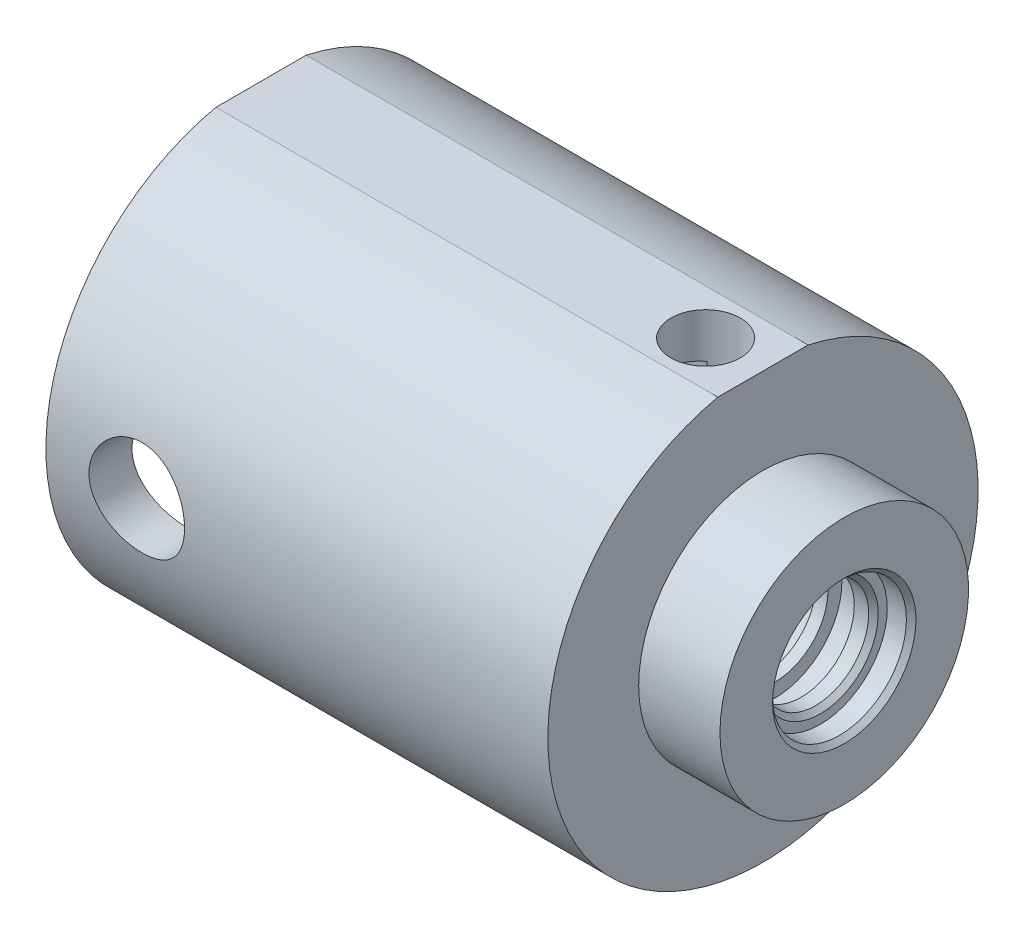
SolidWorks part; units mm, degrees
ref_plane "Face" through (0, 0, 0) normal (0, 0, 1) x (1, 0, 0)
ref_plane "Dessus" through (0, 0, 0) normal (0, 1, 0) x (1, 0, 0)
ref_plane "Droite" through (0, 0, 0) normal (1, 0, 0) x (0, 0, -1)
sketch "Esquisse1" plane through (0, 0, 0) normal (0, 0, 1) x (1, 0, 0)
  line L0 (0, 0) -> (148.1373, 0) construction
  line L1 (0, 0) -> (0, 45)
  line L2 (0, 45) -> (105, 45)
  line L5 (105, 45) -> (105, 26)
  line L6 (105, 26) -> (122, 26)
  line L7 (122, 26) -> (122, 0)
  line L8 (122, 0) -> (0, 0)
  dimension "D2" = 26
  dimension "D3" = 45
  dimension "D5" = 122
  dimension "D6" = 17
revolve "Révolution1" add sketch "Esquisse1" angle 360 about L0
sketch "Esquisse2" plane through (0, 0, 0) normal (0, 0, 1) x (1, 0, 0)
  line L0 (0, 0) -> (0, 36)
  line L1 (0, 45) -> (0, -45) construction
  line L2 (0, 36) -> (3, 36)
  line L3 (3, 36) -> (3, 37.5)
  line L4 (3, 37.5) -> (7, 37.5)
  line L5 (7, 37.5) -> (7, 36)
  line L6 (7, 36) -> (32, 36)
  line L7 (32, 36) -> (34.7475, 35)
  line L8 (34.7475, 35) -> (88, 35)
  line L9 (88, 35) -> (88, 11.1)
  line L10 (88, 11.1) -> (89.8, 11.1)
  line L11 (89.8, 11.1) -> (89.8, 13)
  line L12 (89.8, 13) -> (105, 13)
  line L13 (105, 13) -> (105, 11.1)
  line L14 (105, 11.1) -> (107.5, 11.1)
  line L15 (107.5, 11.1) -> (107.5, 14)
  line L16 (107.5, 14) -> (113, 14)
  line L17 (113, 14) -> (113, 11.1)
  line L18 (113, 11.1) -> (117, 11.1)
  line L19 (117, 11.1) -> (117, 14)
  line L20 (117, 14) -> (122, 14)
  line L21 (122, -26) -> (122, 26) construction
  line L22 (122, 14) -> (122, 0)
  line L23 (122, 0) -> (0, 0)
  dimension "D1" = 11.1
  dimension "D2" = 13
  dimension "D3" = 5
  dimension "D4" = 9
  dimension "D5" = 5.5
  dimension "D6" = 17
  dimension "D7" = 15.2
  dimension "D8" = 88
  dimension "D9" = 3
  dimension "D10" = 4
  dimension "D11" = 32
  dimension "D12" = 160
  dimension "D13" = 35
  dimension "D14" = 36
  dimension "D15" = 37.5
  dimension "D16" = 36
  dimension "D17" = 14
revolve "Enlèvement de matière-Révolution1" cut sketch "Esquisse2" angle 360 about L23
chamfer "Chanfrein1" distance 1 angle 45 2 edges at (117, 0, -11.1) (122, 0, -14)
sketch "Esquisse4" plane through (105, 0, 0) normal (1, 0, 0) x (0, 0, -1)
  line L1 (72.23, 44) -> (-59.9876, 44)
  line L2 (72.23, 44) -> (72.23, 74.7808)
  line L3 (72.23, 74.7808) -> (-59.9876, 74.7808)
  line L4 (-59.9876, 44) -> (-59.9876, 74.7808)
  dimension "D1" = 44
extrude "Enlèv. mat.-Extru.1" cut sketch "Esquisse4" against normal through all
hole_wizard "Trou taraudé G3/8" positions "Esquisse6" profile "Esquisse5" tap size "M16x1.5" standard "Ansi Métrique"
sketch "Esquisse6" plane through (0, 44, 0) normal (0, 1, 0) x (-1, 0, 0)
  line L0 (-105, -9.434) -> (-105, 9.434) construction
  line L1 (0, 0) -> (-148.1373, 0) construction
  point P0 (-93, 0)
  dimension "D1" = 12
sketch "Esquisse5" plane through (93, 44, 0) normal (1, 0, 0) x (0, 0, 1)
  line L0 (0, 0) -> (0, 26.8562)
  line L1 (0, 26.8562) -> (7.25, 22.5)
  line L2 (7.25, 22.5) -> (7.25, 0)
  line L5 (7.25, 0) -> (0, 0)
  line L10 (0, 26.8562) -> (-7.25, 22.5) construction
  line L11 (0, -6.35) -> (0, 107.95) construction
  dimension "Diamètre du trou pour taraudage" = 14.5
  dimension "Profondeur du trou pour taraudage" = 22.5
  dimension "Angle de pointe" = 118
ref_plane "Plan1" through (0, 0, 0) normal (0, 0, 1) x (1, 0, 0)
sketch "Esquisse7" plane through (0, 0, 0) normal (0, 0, 1) x (1, 0, 0)
  line L0 (0, 0) -> (148.1373, 0) construction
  line L1 (0, 44) -> (0, -45) construction
  circle A0 centre (19, 0) radius 10
  dimension "D1" = 20
  dimension "D2" = 19
extrude "Enlèv. mat.-Extru.2" cut sketch "Esquisse7" against normal through all and the other way through all
